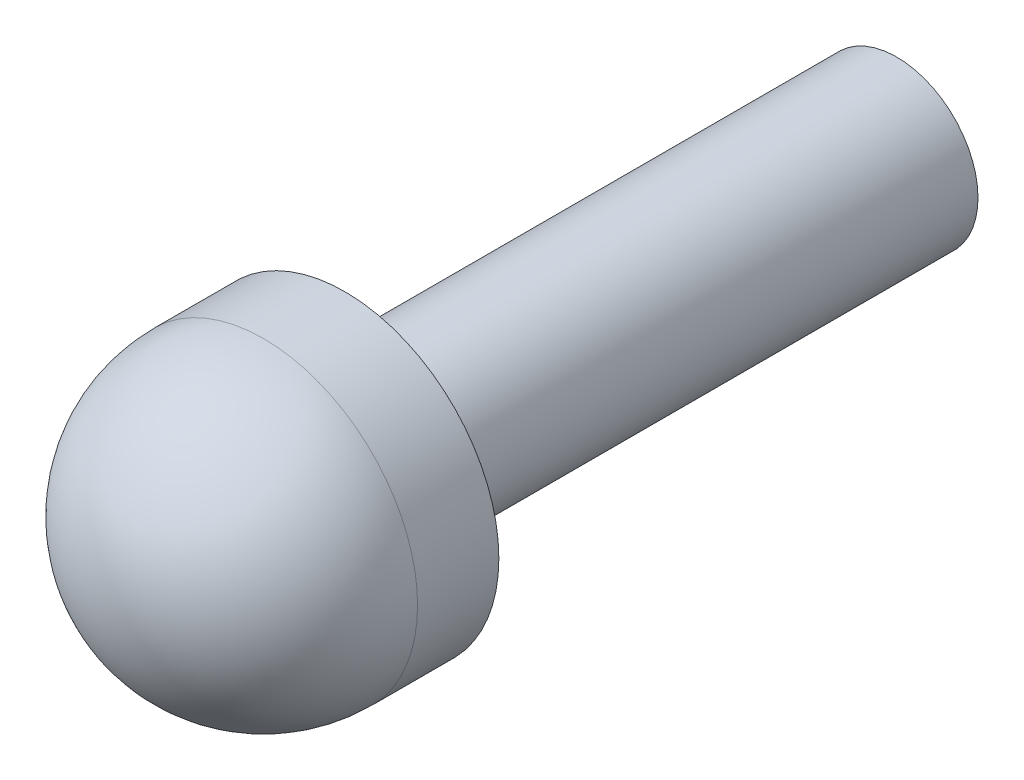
SolidWorks part; units mm, degrees
ref_plane "Спереди" through (0, 0, 0) normal (0, 0, 1) x (1, 0, 0)
ref_plane "Сверху" through (0, 0, 0) normal (0, 1, 0) x (1, 0, 0)
ref_plane "Справа" through (0, 0, 0) normal (1, 0, 0) x (0, 0, -1)
sketch "Эскиз1" plane through (0, 0, 0) normal (1, 0, 0) x (0, 0, -1)
  line L0 (0, 0) -> (44.8307, 0) construction
  line L1 (0, 0) -> (4.6736, 0)
  line L2 (4.6736, 0) -> (4.6736, 0.4826)
  line L3 (4.6736, 0.4826) -> (1.397, 0.4826)
  line L4 (1.397, 0.4826) -> (1.397, 0.9144)
  line L5 (1.397, 0.9144) -> (0.9144, 0.9144)
  arc A0 (0, 0) -> (0.9144, 0.9144) centre (0.9144, 0) cw
  dimension "D1" = 0.9652
  dimension "D2" = 1.8288
  dimension "D3" = 4.6736
  dimension "D4" = 1.397
revolve "Повернуть1" add sketch "Эскиз1" angle 360 about L0
